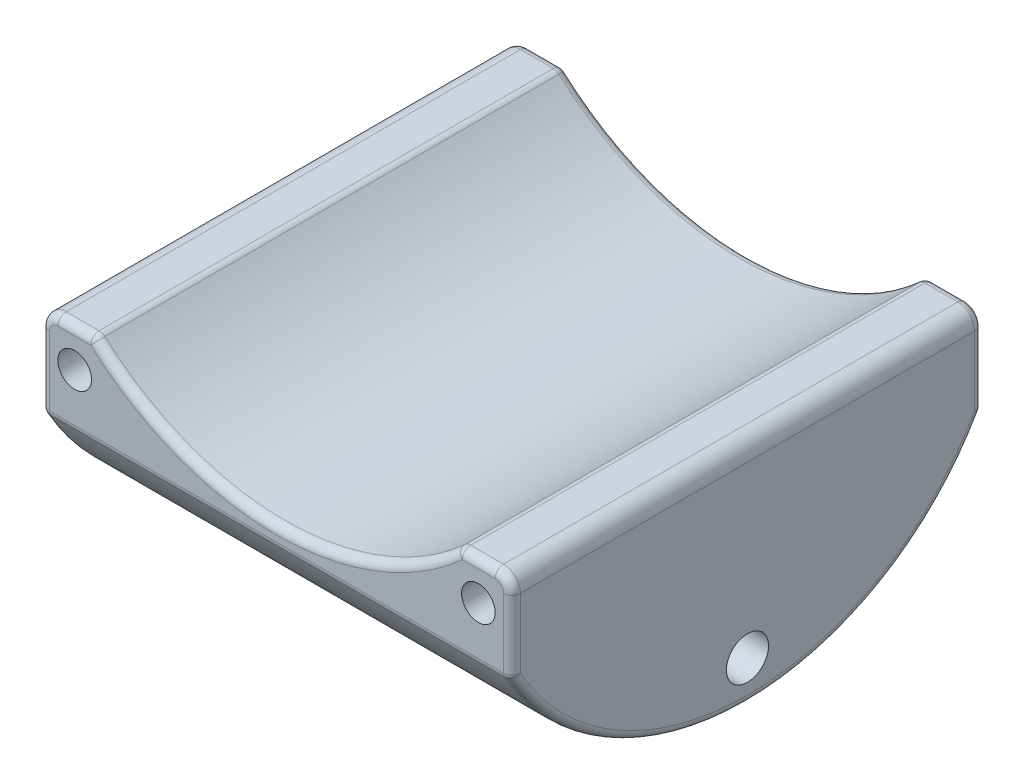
SolidWorks part; units mm, degrees
ref_plane "Front" through (0, 0, 0) normal (0, 0, 1) x (1, 0, 0)
ref_plane "Top" through (0, 0, 0) normal (0, 1, 0) x (1, 0, 0)
ref_plane "Right" through (0, 0, 0) normal (1, 0, 0) x (0, 0, -1)
sketch "Sketch1" plane through (0, 0, 0) normal (1, 0, 0) x (0, 0, -1)
  line L0 (-44.45, 0) -> (44.45, 0)
  line L1 (0, 55.88) -> (0, -72.5415) construction
  line L2 (-44.45, 0) -> (-44.45, -16.6432)
  line L3 (44.45, 0) -> (44.45, -16.6432)
  arc A0 (-44.45, -16.6432) -> (44.45, -16.6432) centre (0, 7.9502) ccw
  dimension "D1" = 50.8
  dimension "D2" = 42.8498
  dimension "D3" = 88.9
extrude "Base-Extrude" add sketch "Sketch1" along normal mid plane 88.9
sketch "Sketch2" plane through (0, 0, 44.45) normal (0, 0, 1) x (1, 0, 0)
  line L0 (44.45, 0) -> (-44.45, 0) construction
  line L1 (0, -50) -> (0, 50) construction
  line L2 (44.45, -16.6432) -> (-44.45, -16.6432) construction
  arc A0 (-34.4526, 0) -> (34.4526, 0) centre (0, 37.3318) ccw
  dimension "D1" = 50.8
  dimension "D2" = 53.975
extrude "Cut-Extrude1" cut sketch "Sketch2" against normal through all
fillet "Fillet1" radius 3.175 2 edges at (44.45, 0, 0) (-44.45, 0, 0)
other "Hole1" parameters "D1"=20.6375
sketch "Sketch3" plane through (0, 0, 44.45) normal (0, 0, 1) x (1, 0, 0)
  line L0 (-34.4526, 0) -> (-41.275, 0) construction
  line L1 (0, -50) -> (0, 50) construction
  circle A0 centre (-38.1, -7.1374) radius 3.175
  dimension "D1" = 6.35
  dimension "D2" = 7.1374
  dimension "D3" = 38.1
pattern_linear "LPattern1" count 2 spacing 76.2 along (1, 0, 0) of "Hole1"
mirror "Mirror1" about plane through (0, 0, 0) normal (0, 0, 1) of "LPattern1"
other "Hole2" parameters "D1"=17.4625
sketch "Sketch4" plane through (44.45, 0, 0) normal (1, 0, 0) x (0, 0, -1)
  line L0 (0, 50) -> (0, -50) construction
  line L1 (-44.45, 0) -> (44.45, 0) construction
  circle A0 centre (0, -35.179) radius 3.9751
  dimension "D1" = 7.9502
  dimension "D2" = 35.179
mirror "Mirror2" about plane through (0, 0, 0) normal (1, 0, 0) of "Hole2"
fillet "Fillet2" radius 1.5875 4 edges at (-34.4526, 0, 0) (34.4526, 0, 0) (0, -16.6432, -44.45) (0, -16.6432, 44.45)
fillet "Fillet3" radius 1.5875 24 edges at (38.1713, 0, -44.45) (38.1713, 0, 44.45) (44.45, -9.7024, -44.45) (-44.45, -9.7024, -44.45) (-43.5201, -0.9299, -44.45) (43.5201, -0.9299, -44.45) (44.45, -9.7024, 44.45) (-44.45, -9.7024, 44.45) (-43.5201, -0.9299, 44.45) (43.5201, -0.9299, 44.45) (-38.1713, 0, -44.45) (-38.1713, 0, 44.45) (0, -13.4682, -44.45) (34.4985, -0.1055, -44.45) (-34.4985, -0.1055, -44.45) (0, -13.4682, 44.45) (34.4985, -0.1055, 44.45) (-34.4985, -0.1055, 44.45) (-44.45, -42.8498, 0) (44.45, -42.8498, 0) (-44.45, -16.6331, -44.3979) (-44.45, -16.6331, 44.3979) (44.45, -16.6331, -44.3979) (44.45, -16.6331, 44.3979)
